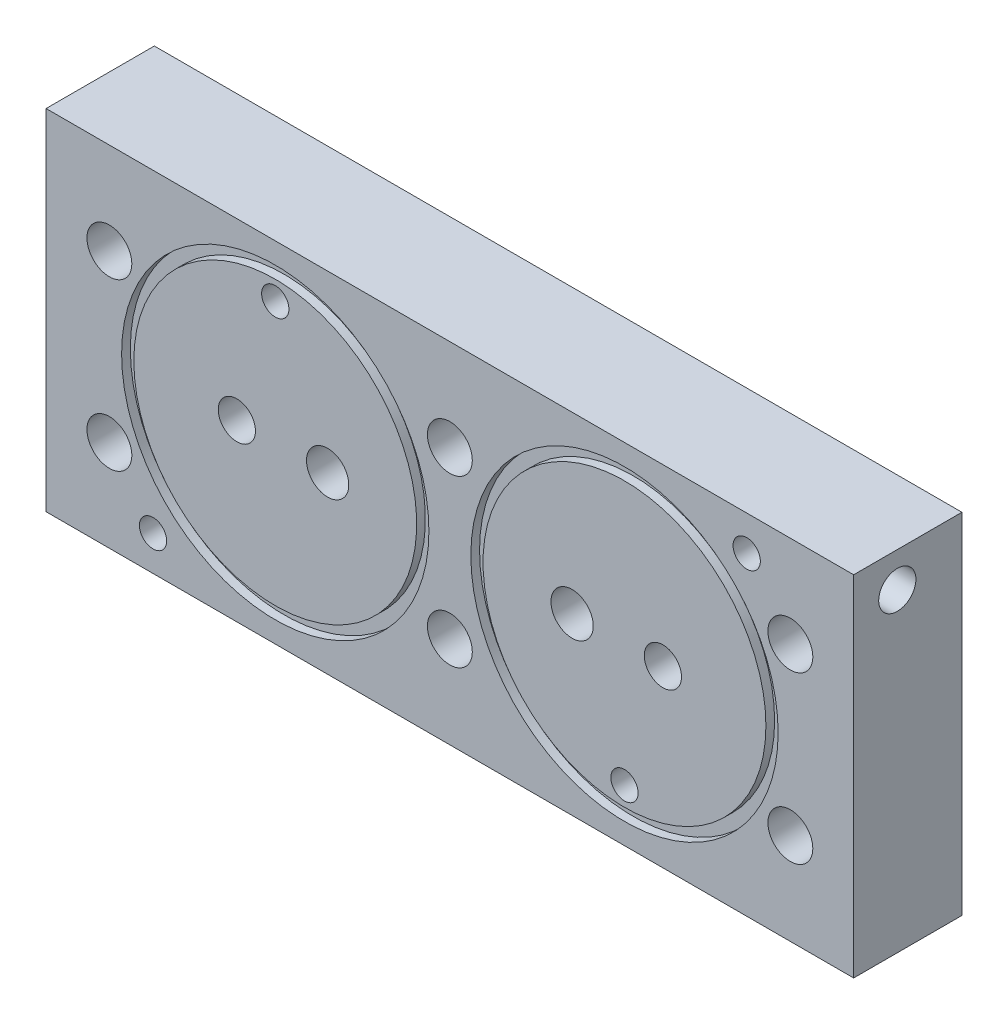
SolidWorks part; units mm, degrees
ref_plane "Front/Back" through (0, 0, 0) normal (0, 0, 1) x (1, 0, 0)
ref_plane "Top/Bottom" through (0, 0, 0) normal (0, 1, 0) x (1, 0, 0)
ref_plane "Right/Left" through (0, 0, 0) normal (1, 0, 0) x (0, 0, -1)
sketch "Sketch1" plane through (0, 0, 0) normal (0, 0, 1) x (1, 0, 0)
  line L0 (58.7375, 25.4) -> (-58.7375, -25.4) construction
  line L1 (-58.7375, 25.4) -> (58.7375, 25.4)
  line L2 (-58.7375, 25.4) -> (-58.7375, -25.4)
  line L3 (-58.7375, -25.4) -> (58.7375, -25.4)
  line L4 (58.7375, 25.4) -> (58.7375, -25.4)
  dimension "D1" = 117.475
  dimension "D2" = 50.8
extrude "Extrude1" add sketch "Sketch1" along normal mid plane 15.748
sketch "Sketch2" plane through (0, 0, 7.874) normal (0, 0, 1) x (1, 0, 0)
  line L0 (0, 0) -> (0, 28.5267) construction
  line L1 (0, 0) -> (11.122, 0) construction
  circle A0 centre (-49.53, 12.065) radius 3.2639
  circle A1 centre (0, 12.065) radius 3.2639
  circle A2 centre (49.53, 12.065) radius 3.2639
  circle A3 centre (49.53, -12.065) radius 3.2639
  circle A4 centre (0, -12.065) radius 3.2639
  circle A5 centre (-49.53, -12.065) radius 3.2639
  dimension "D1" = 6.5278
  dimension "D3" = 49.53
  dimension "D2" = 12.065
extrude "Cut-Extrude1" cut sketch "Sketch2" against normal through all
hole_wizard "5/32 (0.15625) Diameter Hole1" positions "Sketch4" profile "Sketch3" hole size "5/32" standard "Ansi Inch"
sketch "Sketch4" plane through (0, 0, 7.874) normal (0, 0, 1) x (1, 0, 0)
  line L0 (0, 0) -> (0, 28.6965) construction
  line L1 (0, 0) -> (13.4993, 0) construction
  point P0 (-25.4, 17.78)
  point P1 (25.4, -17.78)
  dimension "D1" = 25.4
  dimension "D2" = 17.78
  dimension "D3" = 25.4
  dimension "D4" = 17.78
sketch "Sketch3" plane through (-25.4, 17.78, 7.874) normal (1, 0, 0) x (0, -1, 0)
  line L0 (0, 0) -> (0, 10.0823)
  line L1 (0, 10.0823) -> (1.9844, 8.89)
  line L2 (1.9844, 8.89) -> (1.9844, 0)
  line L5 (1.9844, 0) -> (0, 0)
  line L10 (0, 10.0823) -> (-1.9844, 8.89) construction
  line L11 (0, -6.35) -> (0, 107.95) construction
  dimension "Hole Dia." = 3.9688
  dimension "Hole Depth" = 8.89
  dimension "Drill Angle" = 118
hole_wizard "5/32 (0.15625) Diameter Hole2" positions "Sketch10" profile "Sketch9" hole size "5/32" standard "Ansi Inch"
sketch "Sketch10" plane through (0, 0, 7.874) normal (0, 0, 1) x (1, 0, 0)
  line L0 (0, 0) -> (0, 10.1881) construction
  line L1 (0, 0) -> (9.5938, 0) construction
  point P0 (-43.18, -20.32)
  point P1 (43.18, 20.32)
  dimension "D1" = 43.18
  dimension "D2" = 43.18
  dimension "D3" = 20.32
  dimension "D4" = 20.32
sketch "Sketch9" plane through (-43.18, -20.32, 7.874) normal (1, 0, 0) x (0, -1, 0)
  line L0 (0, 0) -> (0, 10.0823)
  line L1 (0, 10.0823) -> (1.9844, 8.89)
  line L2 (1.9844, 8.89) -> (1.9844, 0)
  line L5 (1.9844, 0) -> (0, 0)
  line L10 (0, 10.0823) -> (-1.9844, 8.89) construction
  line L11 (0, -6.35) -> (0, 107.95) construction
  dimension "Hole Dia." = 3.9688
  dimension "Hole Depth" = 8.89
  dimension "Drill Angle" = 118
hole_wizard "1/4-28 Tapped Hole1" positions "Sketch6" profile "Sketch5" tap size "1/4-28" standard "Ansi Inch"
sketch "Sketch6" plane through (0, 0, 7.874) normal (0, 0, 1) x (1, 0, 0)
  line L0 (0, 0) -> (12.3106, 0) construction
  line L1 (0, 0) -> (0, 31.4134) construction
  circle A1 centre (-25.4, 17.78) radius 1.9844 construction
  point P0 (-30.988, 0)
  point P1 (30.988, 0)
  dimension "D1" = 5.588
sketch "Sketch5" plane through (-30.988, 0, 7.874) normal (1, 0, 0) x (0, -1, 0)
  line L0 (0, 0) -> (0, 15.748)
  line L1 (0, 15.748) -> (2.7051, 15.748)
  line L2 (2.7051, 15.748) -> (2.7051, 0)
  line L5 (2.7051, 0) -> (0, 0)
  line L11 (0, -6.35) -> (0, 107.95) construction
  dimension "Thru Tap Drill Dia." = 5.4102
  dimension "Thru Tap Drill Depth" = 15.748
hole_wizard "Sensor Plugs" positions "Sketch8" profile "Sketch7" size "1/16" standard "Ansi Inch"
sketch "Sketch8" plane through (0, 0, -7.874) normal (0, 0, -1) x (-1, 0, 0)
  line L0 (0, 0) -> (7.0468, 0) construction
  line L1 (0, 0) -> (0, 13.2446) construction
  point P0 (-17.78, 0)
  point P1 (17.78, 0)
  dimension "D1" = 35.56
sketch "Sketch7" plane through (17.78, 0, -7.874) normal (1, 0, 0) x (0, 1, 0)
  line L0 (0, 0) -> (0, 15.748)
  line L1 (0, 15.748) -> (3.0734, 15.748)
  line L2 (-3.3648, 6.8859) -> (-3.571, 0) construction
  line L3 (3.0734, 15.748) -> (3.0734, 6.8859)
  line L4 (3.0734, 6.8859) -> (3.3648, 6.8859)
  line L5 (3.3648, 6.8859) -> (3.571, 0)
  line L7 (3.571, 0) -> (0, 0)
  line L8 (0, -6.35) -> (0, 107.95) construction
  line L11 (-3.0734, 6.8859) -> (-3.3648, 6.8859) construction
  dimension "Thru Tap Drill Dia." = 6.1468
  dimension "Thru Tap Drill Depth" = 15.748
  dimension "Thread Dia." = 7.142
  dimension "Thread Angle" = 3.43
  dimension "Thread Depth" = 6.8859
sketch "Sketch11" plane through (0, 0, 7.874) normal (0, 0, 1) x (1, 0, 0)
  line L0 (0, 0) -> (14.7108, 0) construction
  line L1 (0, 0) -> (0, 12.3538) construction
  circle A0 centre (25.4, 0) radius 22.352
  circle A1 centre (25.4, 0) radius 20.574
  circle A2 centre (-25.4, 0) radius 22.352
  circle A3 centre (-25.4, 0) radius 20.574
  dimension "D1" = 44.704
  dimension "D2" = 41.148
  dimension "D3" = 25.4
extrude "Cut-Extrude2" cut sketch "Sketch11" against normal blind 1.27
sketch "Sketch12" plane through (0, 0, -7.874) normal (0, 0, -1) x (-1, 0, 0)
  circle A0 centre (-30.988, 0) radius 6.7437
  circle A1 centre (30.988, 0) radius 6.7437
  dimension "D1" = 13.4874
extrude "Cut-Extrude3" cut sketch "Sketch12" against normal blind 1.27
hole_wizard "5/32 (0.15625) Diameter Hole3" positions "Sketch14" profile "Sketch13" hole size "5/32" standard "Ansi Inch"
sketch "Sketch14" plane through (58.7375, 0, 0) normal (1, 0, 0) x (0, 0, -1)
  line L0 (0, 0) -> (10.7547, 0) construction
  line L1 (-7.874, -25.4) -> (-7.874, 25.4) construction
  point P0 (-1.524, 20.32)
  dimension "D1" = 6.35
  dimension "D2" = 20.32
sketch "Sketch13" plane through (58.7375, 20.32, 1.524) normal (0, 1, 0) x (0, 0, -1)
  line L0 (0, 0) -> (0, 90.0923)
  line L1 (0, 90.0923) -> (1.9844, 88.9)
  line L2 (1.9844, 88.9) -> (1.9844, 0)
  line L5 (1.9844, 0) -> (0, 0)
  line L10 (0, 90.0923) -> (-1.9844, 88.9) construction
  line L11 (0, -6.35) -> (0, 107.95) construction
  dimension "Hole Dia." = 3.9688
  dimension "Hole Depth" = 88.9
  dimension "Drill Angle" = 118
hole_wizard "1/4-28 Tapped Hole2" positions "Sketch16" profile "Sketch15" tap size "1/4-28" standard "Ansi Inch"
sketch "Sketch16" plane through (58.7375, 0, 0) normal (1, 0, 0) x (0, 0, -1)
  circle A2 centre (-1.524, 20.32) radius 1.9844 construction
  point P0 (-1.524, 20.32)
sketch "Sketch15" plane through (58.7375, 20.32, 1.524) normal (0, 1, 0) x (0, 0, -1)
  line L0 (0, 0) -> (0, 10.6957)
  line L1 (0, 10.6957) -> (2.7051, 9.0703)
  line L2 (2.7051, 9.0703) -> (2.7051, 0)
  line L5 (2.7051, 0) -> (0, 0)
  line L10 (0, 10.6957) -> (-2.7051, 9.0703) construction
  line L11 (0, -6.35) -> (0, 107.95) construction
  dimension "Tap Drill Dia." = 5.4102
  dimension "Tap Drill Depth" = 9.0703
  dimension "Drill Angle" = 118
sketch "Sketch17" plane through (0, 0, -7.874) normal (0, 0, -1) x (-1, 0, 0)
  line L0 (0, 0) -> (0, 34.9483) construction
  line L1 (0, 0) -> (16.6614, 0) construction
  circle A0 centre (0, 12.065) radius 4.7625
  circle A1 centre (-49.53, 12.065) radius 4.7625
  circle A2 centre (49.53, 12.065) radius 4.7625
  circle A3 centre (-49.53, -12.065) radius 4.7625
  circle A4 centre (49.53, -12.065) radius 4.7625
  circle A5 centre (0, -12.065) radius 4.7625
  dimension "D1" = 9.525
extrude "Cut-Extrude4" cut sketch "Sketch17" against normal blind 3.302
hole_wizard "5/32 (0.15625) Diameter Hole4" positions "Sketch19" profile "Sketch18" hole size "5/32" standard "Ansi Inch"
sketch "Sketch19" plane through (-58.7375, 0, 0) normal (-1, 0, 0) x (0, 0, 1)
  line L0 (1.524, 20.32) -> (1.524, 11.4224) construction
  line L1 (0, 0) -> (4.4987, 0) construction
  point P0 (1.524, -20.32)
  dimension "D1" = 20.32
sketch "Sketch18" plane through (-58.7375, -20.32, 1.524) normal (0, 1, 0) x (0, 0, 1)
  line L0 (0, 0) -> (0, 90.0923)
  line L1 (0, 90.0923) -> (1.9844, 88.9)
  line L2 (1.9844, 88.9) -> (1.9844, 0)
  line L5 (1.9844, 0) -> (0, 0)
  line L10 (0, 90.0923) -> (-1.9844, 88.9) construction
  line L11 (0, -6.35) -> (0, 107.95) construction
  dimension "Hole Dia." = 3.9688
  dimension "Hole Depth" = 88.9
  dimension "Drill Angle" = 118
hole_wizard "1/4-28 Tapped Hole4" positions "Sketch24" profile "Sketch23" tap size "1/4-28" standard "Ansi Inch"
sketch "Sketch24" plane through (-58.7375, 0, 0) normal (-1, 0, 0) x (0, 0, 1)
  circle A0 centre (1.524, -20.32) radius 1.9844 construction
  point P0 (1.524, -20.32)
sketch "Sketch23" plane through (-58.7375, -20.32, 1.524) normal (0, 1, 0) x (0, 0, 1)
  line L0 (0, 0) -> (0, 10.6957)
  line L1 (0, 10.6957) -> (2.7051, 9.0703)
  line L2 (2.7051, 9.0703) -> (2.7051, 0)
  line L5 (2.7051, 0) -> (0, 0)
  line L10 (0, 10.6957) -> (-2.7051, 9.0703) construction
  line L11 (0, -6.35) -> (0, 107.95) construction
  dimension "Tap Drill Dia." = 5.4102
  dimension "Tap Drill Depth" = 9.0703
  dimension "Drill Angle" = 118
